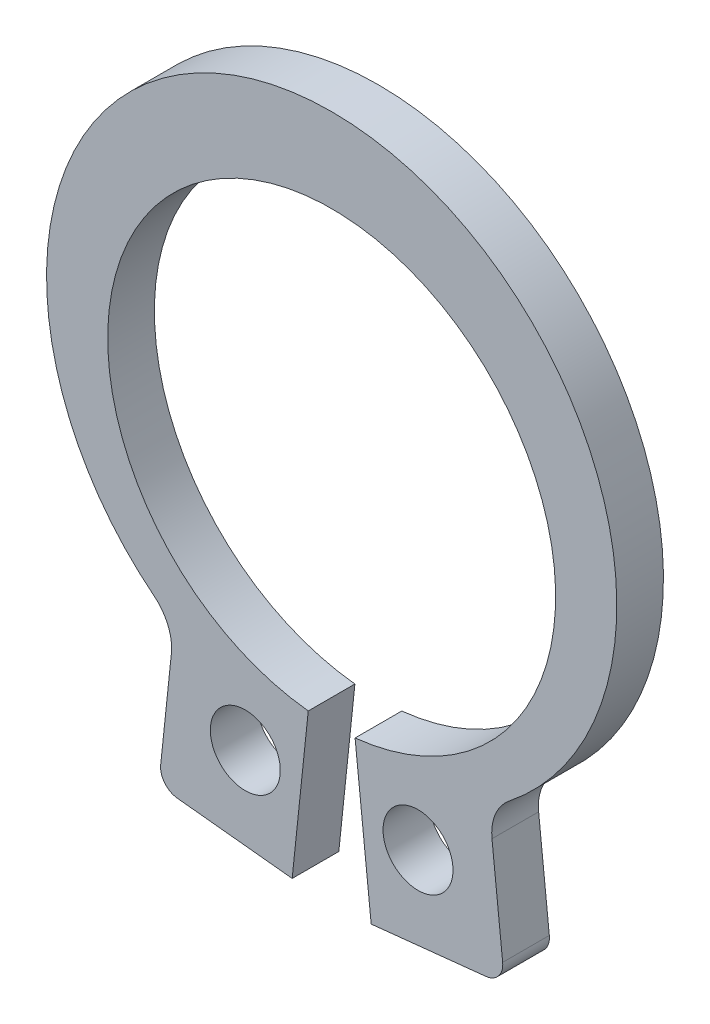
SolidWorks part; units mm, degrees
ref_plane "Face" through (0, 0, 0) normal (0, 0, 1) x (1, 0, 0)
ref_plane "Dessus" through (0, 0, 0) normal (0, 1, 0) x (1, 0, 0)
ref_plane "Droite" through (0, 0, 0) normal (1, 0, 0) x (0, 0, -1)
sketch "Esquisse1" plane through (0, 0, 0) normal (0, 0, 1) x (1, 0, 0)
  line L0 (-0.5017, -4.7737) -> (-0.8467, -8.0556)
  line L1 (-0.8467, -8.0556) -> (-3.3086, -7.7969)
  line L2 (-3.6646, -7.3572) -> (-3.4355, -5.1772)
  line L3 (3.4355, -5.1772) -> (3.6646, -7.3572)
  line L4 (3.3086, -7.7969) -> (0.8467, -8.0556)
  line L5 (0.8467, -8.0556) -> (0.5017, -4.7737)
  arc A0 (0.5017, -4.7737) -> (-0.5017, -4.7737) centre (0, 0) ccw
  arc A1 (-3.3086, -7.7969) -> (-3.6646, -7.3572) centre (-3.2668, -7.3991) cw
  arc A2 (-3.4355, -5.1772) -> (-3.807, -4.2905) centre (-4.43, -5.0727) ccw
  arc A3 (-3.807, -4.2905) -> (3.807, -4.2905) centre (0, 0.4893) cw
  arc A4 (3.807, -4.2905) -> (3.4355, -5.1772) centre (4.43, -5.0727) ccw
  arc A5 (3.6646, -7.3572) -> (3.3086, -7.7969) centre (3.2668, -7.3991) cw
extrude "Base-Extrusion" add sketch "Esquisse1" along normal blind 1
sketch "Esquisse2" plane through (0, 0, 0) normal (0, 0, 1) x (1, 0, 0)
  arc A0 (2.6008, -6.1788) -> (1.1008, -6.1788) centre (1.8508, -6.1788) cw
  arc A1 (1.1008, -6.1788) -> (2.6008, -6.1788) centre (1.8508, -6.1788) cw
extrude "Enlèv. mat.-Extru.1" cut sketch "Esquisse2" along normal blind 1
sketch "Esquisse3" plane through (0, 0, 0) normal (0, 0, 1) x (1, 0, 0)
  arc A0 (-2.6008, -6.1788) -> (-1.1008, -6.1788) centre (-1.8508, -6.1788) cw
  arc A1 (-1.1008, -6.1788) -> (-2.6008, -6.1788) centre (-1.8508, -6.1788) cw
extrude "Enlèv. mat.-Extru.2" cut sketch "Esquisse3" along normal blind 1
